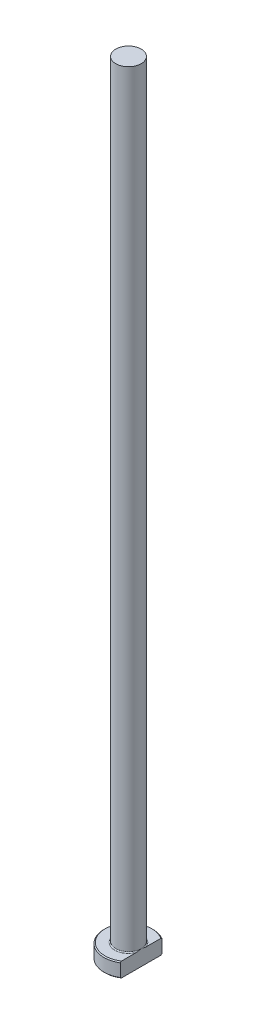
SolidWorks part; units mm, degrees
ref_plane "Front Plane" through (0, 0, 0) normal (0, 0, 1) x (1, 0, 0)
ref_plane "Top Plane" through (0, 0, 0) normal (0, 1, 0) x (1, 0, 0)
ref_plane "Right Plane" through (0, 0, 0) normal (1, 0, 0) x (0, 0, -1)
sketch "Sketch1" plane through (0, 0, 0) normal (0, 0, 1) x (1, 0, 0)
  line L0 (0, 259.9588) -> (0, -15.1925) construction
  line L1 (0, 0) -> (-5, 0)
  line L2 (-5, 0) -> (-5, 3)
  line L3 (-5, 3) -> (-2.6, 3)
  line L4 (-2.6, 3) -> (-2.6, 160)
  line L5 (-2.6, 160) -> (0, 160)
  line L6 (0, 160) -> (0, 0)
  dimension "L" = 160
  dimension "H" = 10
  dimension "T" = 3
  dimension "D" = 5.2
revolve "Revolve1" add sketch "Sketch1" angle 360 about L0
chamfer "Chamfer1" distance 0.2 angle 45 2 edges at (0, 3, 5) (0, 0, 5)
fillet "Fillet1" radius 0.2 1 edges at (0, 3, 2.6)
sketch "Sketch2" plane through (0, 0, 0) normal (0, 1, 0) x (1, 0, 0)
  line L0 (2.6, 4.2708) -> (2.6, -4.2708)
  circle A0 centre (0, 0) radius 5 construction
  arc A1 (2.6, -4.2708) -> (2.6, 4.2708) centre (0, 0) ccw
  circle A2 centre (0, 0) radius 2.6 construction
extrude "KEY" cut sketch "Sketch2" along normal through all
